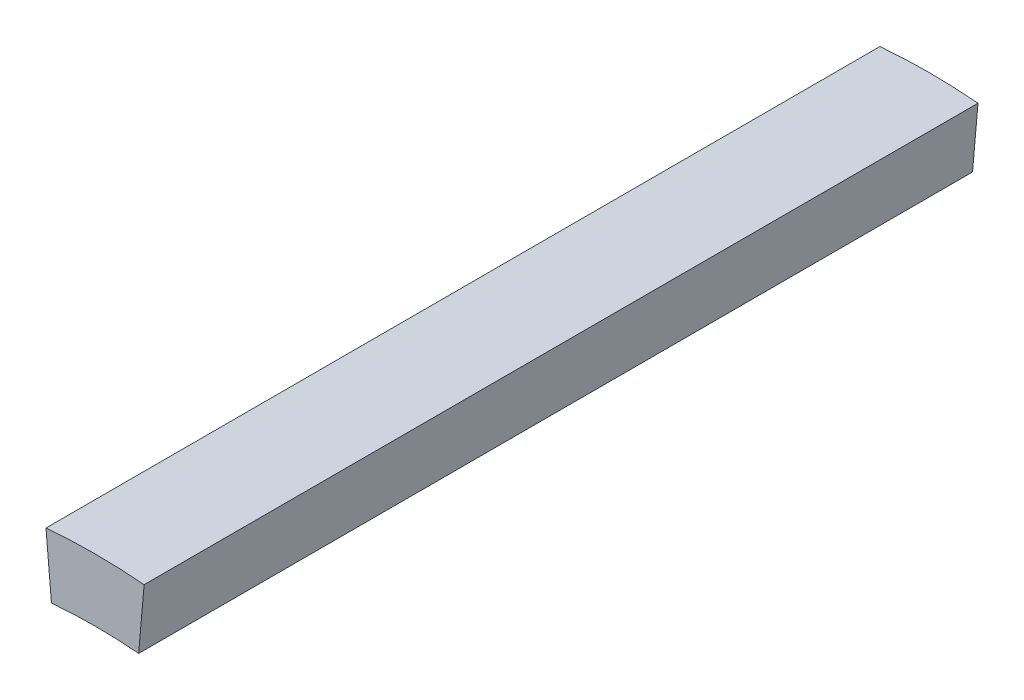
SolidWorks part; units mm, degrees
ref_plane "Face" through (0, 0, 0) normal (0, 0, 1) x (1, 0, 0)
ref_plane "Dessus" through (0, 0, 0) normal (0, 1, 0) x (1, 0, 0)
ref_plane "Droite" through (0, 0, 0) normal (1, 0, 0) x (0, 0, -1)
sketch "Esquisse1" plane through (0, 0, 0) normal (0, 0, 1) x (1, 0, 0)
  line L0 (-0.5883, 6.7243) -> (-0.5229, 5.9772)
  line L1 (0.5229, 5.9772) -> (0.5883, 6.7243)
  line L2 (0, 0) -> (0, 29.8298) construction
  arc A0 (-0.5883, 6.7243) -> (0.5883, 6.7243) centre (0, 0) cw
  arc A1 (-0.5229, 5.9772) -> (0.5229, 5.9772) centre (0, 0) cw
  dimension "D1" = 6
  dimension "D2" = 6.75
  dimension "D3" = 10
extrude "Boss.-Extru.1" add sketch "Esquisse1" along normal blind 10
